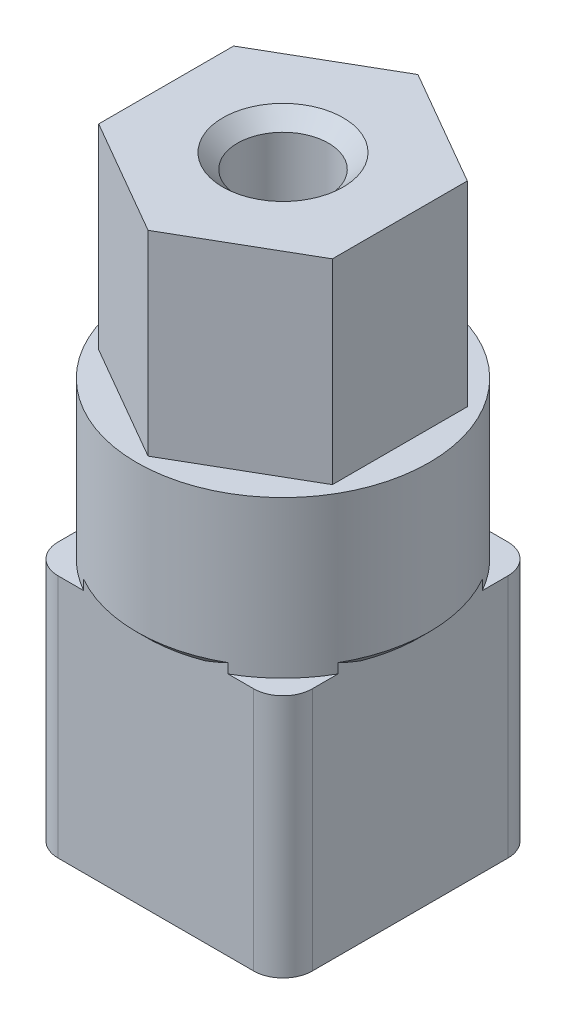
SolidWorks part; units mm, degrees
ref_plane "Front Plane" through (0, 0, 0) normal (0, 0, 1) x (1, 0, 0)
ref_plane "Top Plane" through (0, 0, 0) normal (0, 1, 0) x (1, 0, 0)
ref_plane "Right Plane" through (0, 0, 0) normal (1, 0, 0) x (0, 0, -1)
sketch "Sketch1" plane through (0, 0, 0) normal (0, 1, 0) x (1, 0, 0)
  line L1 (10, -13) -> (-10, -13)
  line L2 (13, -10) -> (13, 10)
  line L3 (10, 13) -> (-10, 13)
  line L4 (-13, -10) -> (-13, 10)
  line L5 (13, -13) -> (-13, 13) construction
  line L6 (13, 13) -> (-13, -13) construction
  arc A0 (10, -13) -> (13, -10) centre (10, -10) ccw
  arc A1 (-10, -13) -> (-13, -10) centre (-10, -10) cw
  arc A2 (13, 10) -> (10, 13) centre (10, 10) ccw
  arc A3 (-10, 13) -> (-13, 10) centre (-10, 10) ccw
  point P0 (0, 0)
  dimension "D3" = 3
  dimension "D1" = 26
  dimension "D2" = 26
extrude "Boss-Extrude1" add sketch "Sketch1" along normal blind 25
sketch "Sketch2" plane through (0, 25, 0) normal (0, 1, 0) x (1, 0, 0)
  circle A0 centre (0, 0) radius 14.95
  dimension "D1" = 29.9
extrude "Boss-Extrude2" add sketch "Sketch2" along normal blind 16
sketch "Sketch3" plane through (0, 41, 0) normal (0, 1, 0) x (1, 0, 0)
  line L1 (0, 13.7987) -> (-11.95, 6.8993)
  line L2 (-11.95, 6.8993) -> (-11.95, -6.8993)
  line L3 (-11.95, -6.8993) -> (0, -13.7987)
  line L4 (0, -13.7987) -> (11.95, -6.8993)
  line L5 (11.95, -6.8993) -> (11.95, 6.8993)
  line L6 (11.95, 6.8993) -> (0, 13.7987)
  circle A0 centre (0, 0) radius 11.95 construction
  dimension "D1" = 23.9
extrude "Boss-Extrude3" add sketch "Sketch3" along normal blind 20
sketch "Sketch5" plane through (0, 61, 0) normal (0, 1, 0) x (1, 0, 0)
  circle A0 centre (0, 0) radius 4.65
  dimension "D1" = 9.3
extrude "Cut-Extrude1" cut sketch "Sketch5" against normal through all
chamfer "Chamfer2" distance 1.5 angle 45 1 edges at (0, 61, 4.65)
chamfer "Chamfer3" distance 23 angle 13 1 edges at (0, 0, 4.65)
chamfer "Chamfer4" distance 1 angle 45 4 edges at (14.95, 25, 0) (0, 25, -14.95) (-14.95, 25, 0) (0, 25, 14.95)
